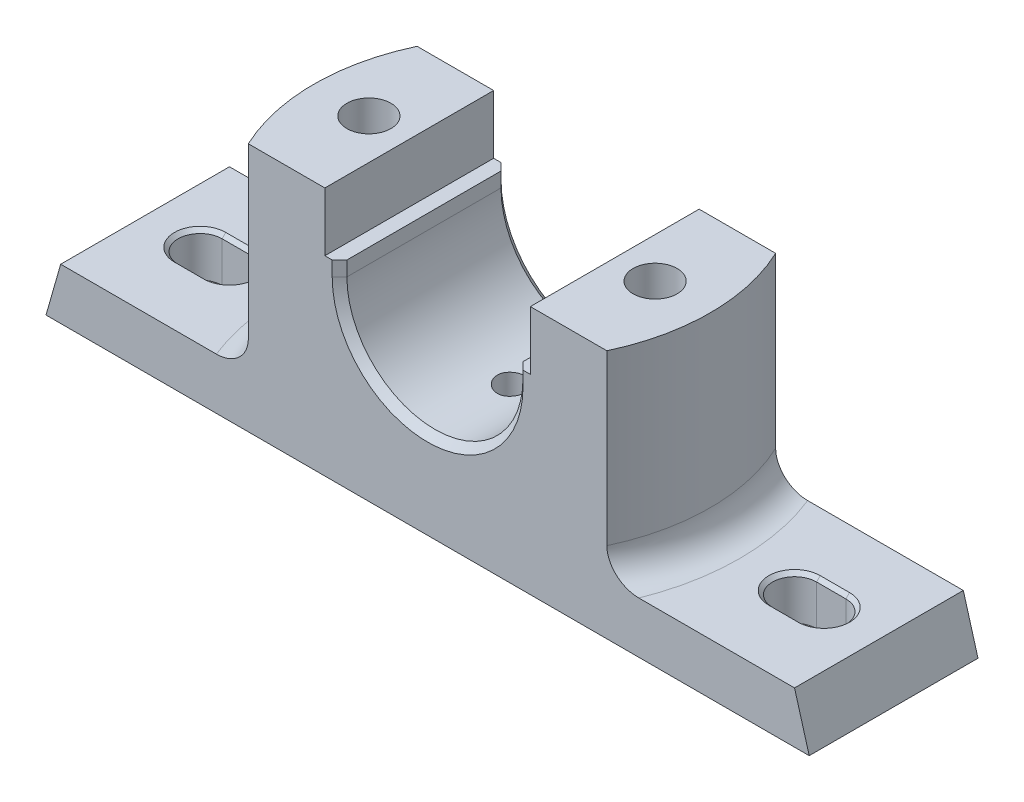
SolidWorks part; units mm, degrees
ref_plane "Front" through (0, 0, 0) normal (0, 0, 1) x (1, 0, 0)
ref_plane "Top" through (0, 0, 0) normal (0, 1, 0) x (1, 0, 0)
ref_plane "Right" through (0, 0, 0) normal (1, 0, 0) x (0, 0, -1)
sketch "Sketch1" plane through (0, 0, 0) normal (0, 0, 1) x (1, 0, 0)
  line L0 (-104, 0) -> (104, 0)
  line L1 (0, 91.4502) -> (0, -4.8887) construction
  line L2 (104, 0) -> (100, 14)
  line L3 (-104, 0) -> (-100, 14)
  line L4 (100, 14) -> (54, 14)
  line L5 (-100, 14) -> (-54, 14)
  line L6 (54, 14) -> (54, 68)
  line L7 (-54, 14) -> (-54, 68)
  line L8 (54, 68) -> (28, 68)
  line L9 (-54, 68) -> (-28, 68)
  line L10 (28, 68) -> (28, 52)
  line L11 (-28, 68) -> (-28, 52)
  line L12 (28, 52) -> (24, 52)
  line L13 (-28, 52) -> (-24, 52)
  line L14 (24, 52) -> (24, 48)
  line L15 (-24, 52) -> (-24, 48)
  arc A0 (24, 48) -> (0, 24) centre (0, 48) cw
  arc A1 (-24, 48) -> (0, 24) centre (0, 48) ccw
  dimension "D7" = 48
  dimension "D1" = 208
  dimension "D2" = 4
  dimension "D3" = 14
  dimension "D4" = 56
  dimension "D5" = 16
  dimension "D6" = 4
  dimension "D8" = 68
  dimension "D9" = 54
extrude "Extrude1" add sketch "Sketch1" along normal mid plane 46
sketch "Sketch3" plane through (0, 68, 0) normal (0, 1, 0) x (-1, 0, 0)
  line L0 (28, -23) -> (54, -23) construction
  line L1 (28, 23) -> (54, 23) construction
  line L2 (54, 23) -> (54, -23) construction
  line L3 (0, 0) -> (0, 34.4965) construction
  line L4 (0, 23) -> (0, -23) construction
  line L5 (-48.8569, 23) -> (48.8569, 23)
  line L6 (-48.8569, -23) -> (48.8569, -23)
  arc A0 (48.8569, -23) -> (48.8569, 23) centre (0, 0) ccw
  arc A1 (-48.8569, -23) -> (-48.8569, 23) centre (0, 0) cw
extrude "Cut-Extrude1" cut sketch "Sketch3" against normal up to surface (54 mm away) flip side to cut
sketch "Sketch6" plane through (0, 0, 0) normal (0, -1, 0) x (1, 0, 0)
  line L0 (-97.5, -17.5) -> (97.5, 17.5) construction
  line L1 (-97.5, 17.5) -> (97.5, 17.5)
  line L2 (-97.5, 17.5) -> (-97.5, -17.5)
  line L3 (-97.5, -17.5) -> (97.5, -17.5)
  line L4 (97.5, 17.5) -> (97.5, -17.5)
  dimension "D1" = 195
  dimension "D2" = 35
extrude "Cut-Extrude5" cut sketch "Sketch6" against normal blind 2
sketch "Sketch4" plane through (0, 2, 0) normal (0, -1, 0) x (1, 0, 0)
  line L0 (0, 31.712) -> (0, -36.3528) construction
  line L2 (0, 23) -> (0, -23) construction
  line L3 (52, -13) -> (26, 13) construction
  line L4 (26, 13) -> (52, 13)
  line L5 (26, 13) -> (26, -13)
  line L6 (26, -13) -> (52, -13)
  line L7 (52, 13) -> (52, -13)
  line L8 (-52, 13) -> (-52, -13)
  line L9 (-26, -13) -> (-52, -13)
  line L10 (-26, 13) -> (-26, -13)
  line L11 (-26, 13) -> (-52, 13)
  circle A0 centre (39, 0) radius 6
  circle A1 centre (-39, 0) radius 6
  dimension "D3" = 12
  dimension "D1" = 78
  dimension "D2" = 26
extrude "Cut-Extrude2" cut sketch "Sketch4" against normal blind 10 contours L4 L7 L6 L5 | L11 L8 L9 L10
other "Hole1"
sketch "Sketch7" plane through (0, 12, 0) normal (0, -1, 0) x (1, 0, 0)
  line L0 (-26, -13) -> (-52, 13) construction
  circle A0 centre (-39, 0) radius 6
  dimension "D1" = 12
other "Hole2"
sketch "Sketch8" plane through (0, 12, 0) normal (0, -1, 0) x (1, 0, 0)
  line L0 (52, -13) -> (26, 13) construction
  circle A0 centre (39, 0) radius 6
  dimension "D1" = 12
sketch "Sketch5"
  line L0 (0, 36.3528) -> (0, -48.1095) construction
  line L1 (0, 23) -> (0, -23) construction
  line L2 (77, 6) -> (85, -6) construction
  line L3 (77, 6) -> (85, 6)
  line L4 (-77, -6) -> (-85, -6)
  line L5 (77, -6) -> (85, -6)
  line L6 (-77, 6) -> (-85, 6)
  arc A0 (77, 6) -> (77, -6) centre (77, 0) ccw
  arc A1 (85, -6) -> (85, 6) centre (85, 0) ccw
  arc A2 (-85, -6) -> (-85, 6) centre (-85, 0) cw
  arc A3 (-77, 6) -> (-77, -6) centre (-77, 0) cw
  point P10 (81, 0)
  point P17 (-81, 0)
chamfer "Chamfer1" distance 2 angle 45
fillet "Fillet1" radius 8
extrude "Cut-Extrude4" cut sketch "Sketch5" against normal through all
chamfer "Chamfer2" distance 1 angle 45
sketch "Sketch9" plane through (0, 0, 0) normal (0, 0, 1) x (1, 0, 0)
  line L0 (0, 0) -> (0, 39.061) construction
  line L3 (0, 24) -> (0, 16)
  line L4 (0, 16) -> (4, 16)
  line L5 (4, 24.3357) -> (4, 16)
  arc A1 (-24, 48) -> (24, 48) centre (0, 48) ccw construction
  arc A2 (0, 24) -> (4, 24.3357) centre (0, 48) ccw
  dimension "D1" = 8
  dimension "D2" = 8
revolve "Cut-Revolve3" cut sketch "Sketch9" angle 360 about L0
